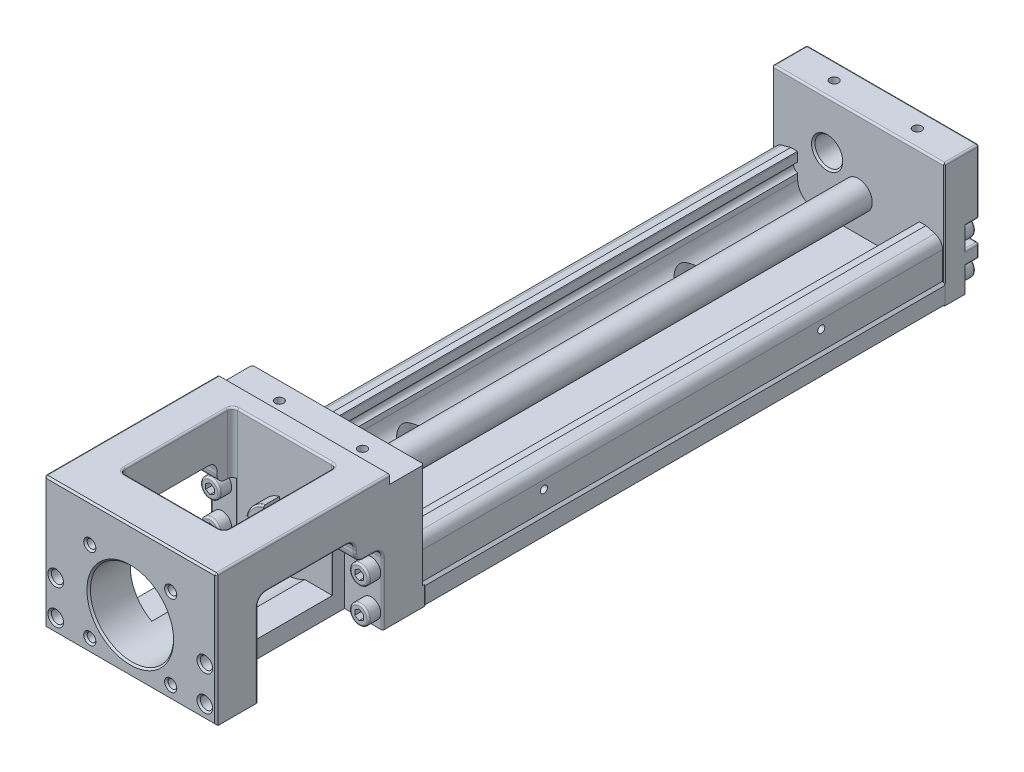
SolidWorks part; units mm, degrees
ref_plane "前视基准面" through (0, 0, 0) normal (0, 0, 1) x (1, 0, 0)
ref_plane "上视基准面" through (0, 0, 0) normal (0, 1, 0) x (1, 0, 0)
ref_plane "右视基准面" through (0, 0, 0) normal (1, 0, 0) x (0, 0, -1)
sketch "Model" plane through (0, 0, 0) normal (0, 0, 1) x (1, 0, 0)
  line L0 (26.1875, 16.7592) -> (26.6875, 16.2592)
  line L1 (23.1875, 16.7592) -> (26.1875, 16.7592)
  line L2 (22.6875, 17.2592) -> (23.1875, 16.7592)
  line L3 (22.6875, 17.2592) -> (22.6875, 22.0592)
  line L4 (23.3875, 22.7592) -> (22.6875, 22.0592)
  line L5 (23.3875, 30.671) -> (23.3875, 22.7592)
  line L6 (28.1875, 34.2592) -> (25.6111, 33.5688)
  line L7 (28.1875, 34.2592) -> (30.0875, 34.2592)
  line L8 (30.1875, 31.6398) -> (30.1875, 33.9592)
  line L9 (30.1875, 27.2592) -> (30.1875, 28.8785)
  line L10 (60.1875, 22.2592) -> (35.1875, 22.2592)
  line L11 (65.1875, 28.8785) -> (65.1875, 27.2592)
  line L12 (65.1875, 33.9592) -> (65.1875, 31.6398)
  line L13 (65.2875, 34.2592) -> (67.1875, 34.2592)
  line L14 (69.764, 33.5688) -> (67.1875, 34.2592)
  line L15 (71.9875, 22.7592) -> (71.9875, 30.671)
  line L16 (72.6875, 22.0592) -> (71.9875, 22.7592)
  line L17 (72.1875, 16.7592) -> (72.6875, 17.2592)
  line L18 (69.1875, 16.7592) -> (72.1875, 16.7592)
  line L19 (68.6875, 16.2592) -> (69.1875, 16.7592)
  line L20 (68.6875, 16.2592) -> (54.6875, 16.2592)
  line L21 (54.1875, 16.7592) -> (54.6875, 16.2592)
  line L22 (41.1875, 16.7592) -> (54.1875, 16.7592)
  line L23 (40.6875, 16.2592) -> (41.1875, 16.7592)
  line L24 (40.6875, 16.2592) -> (26.6875, 16.2592)
  line L25 (72.6875, 22.0592) -> (72.6875, 17.2592)
  arc A0 (25.6111, 33.5688) -> (23.3875, 30.671) centre (26.3875, 30.671) ccw
  arc A1 (30.1875, 33.9592) -> (30.0875, 34.2592) centre (29.6875, 33.9592) ccw
  arc A2 (30.1875, 31.6398) -> (29.0253, 30.2592) centre (30.4965, 30.2002) ccw
  arc A3 (29.0253, 30.2592) -> (30.1875, 28.8785) centre (30.4965, 30.3181) ccw
  arc A4 (30.1875, 27.2592) -> (35.1875, 22.2592) centre (35.1875, 27.2592) ccw
  arc A5 (60.1875, 22.2592) -> (65.1875, 27.2592) centre (60.1875, 27.2592) ccw
  arc A6 (65.1875, 28.8785) -> (66.3498, 30.2592) centre (64.8786, 30.3181) ccw
  arc A7 (66.3498, 30.2592) -> (65.1875, 31.6398) centre (64.8786, 30.2002) ccw
  arc A8 (65.2875, 34.2592) -> (65.1875, 33.9592) centre (65.6875, 33.9592) ccw
  arc A9 (71.9875, 30.671) -> (69.764, 33.5688) centre (68.9875, 30.671) ccw
extrude "凸台-拉伸1" add sketch "Model" along normal mid plane 150
hole_wizard "打孔尺寸(%根据)内六角圆柱头螺钉的类型1" positions "草图2" profile "草图1" counterbore size "M4" standard "GB"
sketch "草图2" plane through (0, 22.2592, 0) normal (0, 1, 0) x (1, 0, 0)
  line L0 (47.6875, -75) -> (47.6875, 75) construction
  line L1 (60.1875, -75) -> (35.1875, -75) construction
  line L2 (60.1875, 75) -> (35.1875, 75) construction
  point P0 (35.1875, -40)
  point P2 (60.1875, -40)
  dimension "D1" = 25
  dimension "D2" = 35
sketch "草图1" plane through (35.1875, 22.2592, 40) normal (1, 0, 0) x (0, 0, 1)
  line L0 (0, 0) -> (0, 6)
  line L1 (0, 6) -> (2.25, 6)
  line L3 (2.25, 6) -> (2.25, 4.6)
  line L4 (2.25, 4.6) -> (4, 4.6)
  line L5 (4, 4.6) -> (4, 0)
  line L7 (4, 0) -> (0, 0)
  line L11 (0, -6.35) -> (0, 107.95) construction
  dimension "通孔孔直径" = 4.5
  dimension "通孔孔深度" = 6
  dimension "柱形沉头孔直径" = 8
  dimension "柱形沉头孔深度" = 4.6
sketch "草图3" plane through (0, 22.2592, 0) normal (0, 1, 0) x (1, 0, 0)
  circle A0 centre (35.1875, -40) radius 4 construction
  circle A1 centre (60.1875, -40) radius 4 construction
  circle A2 centre (35.1875, -40) radius 4
  circle A3 centre (60.1875, -40) radius 4
extrude "切除-拉伸1" cut sketch "草图3" along normal blind 150
pattern_linear "阵列(线性)1" count 2 spacing 80 along (0, 0, -1) of "切除-拉伸1", "打孔尺寸(%根据)内六角圆柱头螺钉的类型1"
hole_wizard "M2.5 螺纹孔1" positions "草图5" profile "草图6" tap size "M2.5" standard "GB"
sketch "草图5" plane through (71.9875, 0, 0) normal (1, 0, 0) x (0, 0, -1)
  line L0 (-75, 22.7592) -> (-75, 30.671) construction
  line L1 (-75, 16.2592) -> (75, 16.2592) construction
  point P0 (-40, 28.2592)
  dimension "D1" = 35
  dimension "D2" = 12
sketch "草图6" plane through (71.9875, 28.2592, 40) normal (0, 1, 0) x (0, 0, -1)
  line L0 (0, 0) -> (0, 5.6159)
  line L1 (0, 5.6159) -> (1.025, 5)
  line L2 (1.025, 5) -> (1.025, 0)
  line L5 (1.025, 0) -> (0, 0)
  line L10 (0, 5.6159) -> (-1.025, 5) construction
  line L11 (0, -6.35) -> (0, 107.95) construction
  dimension "螺纹孔钻头直径" = 2.05
  dimension "螺纹孔钻头深度" = 5
  dimension "导头角度" = 118
hole_wizard "M2.5 螺纹孔2" positions "草图8" profile "草图7" tap size "M2.5" standard "GB"
sketch "草图8" plane through (23.3875, 0, 0) normal (-1, 0, 0) x (0, 0, 1)
  point P0 (40, 28.2592)
sketch "草图7" plane through (23.3875, 28.2592, 40) normal (0, 1, 0) x (0, 0, 1)
  line L0 (0, 0) -> (0, 5.6159)
  line L1 (0, 5.6159) -> (1.025, 5)
  line L2 (1.025, 5) -> (1.025, 0)
  line L5 (1.025, 0) -> (0, 0)
  line L10 (0, 5.6159) -> (-1.025, 5) construction
  line L11 (0, -6.35) -> (0, 107.95) construction
  dimension "螺纹孔钻头直径" = 2.05
  dimension "螺纹孔钻头深度" = 5
  dimension "导头角度" = 118
pattern_linear "阵列(线性)2" count 2 spacing 80 along (0, 0, -1) of "M2.5 螺纹孔2", "M2.5 螺纹孔1"
sketch "草图9" plane through (0, 0, 75) normal (0, 0, 1) x (1, 0, 0)
  line L0 (47.6875, 16.7592) -> (47.6875, 50.1591) construction
  line L1 (22.8875, 54.7592) -> (72.4875, 54.7592)
  line L2 (22.8875, 54.7592) -> (22.8875, 16.7592)
  line L3 (22.8875, 16.7592) -> (72.4875, 16.7592)
  line L4 (72.4875, 54.7592) -> (72.4875, 16.7592)
  line L5 (41.1875, 16.7592) -> (54.1875, 16.7592) construction
  line L6 (26.6875, 16.2592) -> (40.6875, 16.2592) construction
  line L7 (54.6875, 16.2592) -> (68.6875, 16.2592) construction
  circle A0 centre (47.6875, 32.2592) radius 4
  dimension "D4" = 8
  dimension "D5" = 16
  dimension "D1" = 49.6
  dimension "D2" = 0.5
  dimension "D3" = 38.5
extrude "凸台-拉伸2" add sketch "草图9" along normal blind 60
sketch "草图10" plane through (72.4875, 0, 0) normal (1, 0, 0) x (0, 0, -1)
  line L0 (-87, 16.7592) -> (-87, 37.2592)
  line L1 (-135, 16.7592) -> (-75, 16.7592) construction
  line L2 (-87, 37.2592) -> (-95, 37.2592)
  line L3 (-95, 37.2592) -> (-95, 43.2592)
  line L4 (-95, 43.2592) -> (-123, 43.2592)
  line L5 (-123, 43.2592) -> (-123, 16.7592)
  line L6 (-123, 16.7592) -> (-87, 16.7592)
  line L7 (-75, 22.2592) -> (-75, 54.7592) construction
  dimension "D1" = 12
  dimension "D2" = 8
  dimension "D3" = 36
  dimension "D4" = 20.5
  dimension "D5" = 26.5
extrude "切除-拉伸2" cut sketch "草图10" against normal blind 11
sketch "草图11" plane through (22.8875, 0, 0) normal (-1, 0, 0) x (0, 0, 1)
  line L6 (87, 16.7592) -> (123, 16.7592)
  line L7 (87, 37.2592) -> (87, 16.7592)
  line L8 (95, 37.2592) -> (87, 37.2592)
  line L9 (95, 43.2592) -> (95, 37.2592)
  line L10 (123, 43.2592) -> (95, 43.2592)
  line L11 (123, 16.7592) -> (123, 43.2592)
  line L12 (87, 16.7592) -> (123, 16.7592)
  line L13 (87, 37.2592) -> (87, 16.7592)
  line L14 (95, 37.2592) -> (87, 37.2592)
  line L15 (95, 43.2592) -> (95, 37.2592)
  line L16 (123, 43.2592) -> (95, 43.2592)
  line L17 (123, 16.7592) -> (123, 43.2592)
  dimension "D1" = 0
extrude "切除-拉伸3" cut sketch "草图11" against normal blind 11
sketch "草图12" plane through (0, 54.7592, 0) normal (0, 1, 0) x (1, 0, 0)
  line L0 (47.6875, 75) -> (47.6875, -135) construction
  line L1 (60.1875, 75) -> (35.1875, 75) construction
  line L2 (72.4875, -135) -> (22.8875, -135) construction
  line L3 (60.1875, -75) -> (35.1875, -75) construction
  line L4 (32.6875, -90.5) -> (62.6875, -90.5)
  line L5 (32.6875, -90.5) -> (32.6875, -123)
  line L6 (32.6875, -123) -> (62.6875, -123)
  line L7 (62.6875, -90.5) -> (62.6875, -123)
  dimension "D1" = 15.5
  dimension "D2" = 32.5
  dimension "D3" = 30
extrude "切除-拉伸4" cut sketch "草图12" against normal blind 33
sketch "草图13" plane through (0, 0, 135) normal (0, 0, 1) x (1, 0, 0)
  circle A0 centre (47.6875, 32.2592) radius 12
  dimension "D1" = 24
extrude "切除-拉伸5" cut sketch "草图13" against normal up to surface (44.5 mm away)
sketch "草图15" plane through (22.8875, 0, 0) normal (-1, 0, 0) x (0, 0, 1)
  line L1 (75, 54.7592) -> (85, 54.7592)
  line L2 (75, 54.7592) -> (75, 52.2592)
  line L3 (75, 52.2592) -> (85, 52.2592)
  line L4 (85, 54.7592) -> (85, 52.2592)
  dimension "D1" = 2.5
  dimension "D2" = 10
extrude "切除-拉伸6" cut sketch "草图15" against normal through all
hole_wizard "M3 螺纹孔1" positions "草图18" profile "草图17" tap size "M3" standard "GB"
sketch "草图18" plane through (0, 0, 135) normal (0, 0, 1) x (1, 0, 0)
  line L0 (47.6875, 44.2592) -> (47.6875, 32.2592) construction
  line L1 (47.6875, 32.2592) -> (35.6875, 32.2592) construction
  line L3 (36.0203, 43.9264) -> (59.3548, 20.5919) construction
  line L5 (59.3548, 43.9264) -> (36.0203, 20.5919) construction
  circle A0 centre (47.6875, 32.2592) radius 12 construction
  circle A1 centre (47.6875, 32.2592) radius 16.5
  point P0 (36.0203, 43.9264)
  point P16 (59.3548, 20.5919)
  point P18 (59.3548, 43.9264)
  point P19 (36.0203, 20.5919)
  dimension "D1" = 33
  dimension "D2" = 45
sketch "草图17" plane through (36.0203, 43.9264, 135) normal (1, 0, 0) x (0, -1, 0)
  line L0 (0, 0) -> (0, 9.2511)
  line L1 (0, 9.2511) -> (1.25, 8.5)
  line L2 (1.25, 8.5) -> (1.25, 0)
  line L5 (1.25, 0) -> (0, 0)
  line L10 (0, 9.2511) -> (-1.25, 8.5) construction
  line L11 (0, -6.35) -> (0, 107.95) construction
  dimension "螺纹孔钻头直径" = 2.5
  dimension "螺纹孔钻头深度" = 8.5
  dimension "导头角度" = 118
sketch "草图19" plane through (0, 0, 135) normal (0, 0, 1) x (1, 0, 0)
  line L0 (47.6875, 54.7592) -> (47.6875, 16.7592) construction
  line L1 (72.4875, 54.7592) -> (22.8875, 54.7592) construction
  line L2 (22.8875, 16.7592) -> (72.4875, 16.7592) construction
  circle A0 centre (26.1875, 30.7592) radius 1.75
  circle A1 centre (26.1875, 20.7592) radius 1.75
  circle A2 centre (69.1875, 30.7592) radius 1.75
  circle A3 centre (69.1875, 20.7592) radius 1.75
  dimension "D1" = 43
  dimension "D2" = 4
  dimension "D3" = 10
  dimension "D4" = 3.5
extrude "切除-拉伸7" cut sketch "草图19" against normal blind 33
fillet "圆角1" radius 2.5 8 edges at (27.7875, 43.2592, 123) (67.5875, 43.2592, 123) (66.9875, 37.2592, 87) (67.5875, 37.2592, 95) (67.5875, 43.2592, 95) (28.3875, 37.2592, 87) (27.7875, 37.2592, 95) (27.7875, 43.2592, 95)
fillet "圆角2" radius 1.5 4 edges at (32.6875, 47.7592, 123) (32.6875, 46.0092, 90.5) (62.6875, 47.7592, 123) (62.6875, 46.0092, 90.5)
fillet "圆角3" radius 0.5 28 edges at (72.4875, 25.7592, 87) (72.4875, 36.5269, 87.7322) (72.4875, 37.2592, 91) (72.4875, 37.9914, 94.2678) (72.4875, 40.2592, 95) (72.4875, 42.5269, 95.7322) (72.4875, 28.7592, 123) (72.4875, 42.5269, 122.2678) (22.8875, 25.7592, 87) (22.8875, 28.7592, 123) (22.8875, 42.5269, 122.2678) (22.8875, 43.2592, 109) (22.8875, 42.5269, 95.7322) (22.8875, 40.2592, 95) (22.8875, 37.9914, 94.2678) (22.8875, 37.2592, 91) (62.2482, 54.7592, 90.9393) (62.6875, 54.7592, 106.75) (62.2482, 54.7592, 122.5607) (47.6875, 54.7592, 123) (33.1269, 54.7592, 122.5607) (32.6875, 54.7592, 106.75) (33.1269, 54.7592, 90.9393) (72.4875, 43.2592, 109) (22.8875, 36.5269, 87.7322) (47.6875, 54.7592, 90.5) (72.4875, 54.7592, 110) (22.8875, 54.7592, 110)
chamfer "倒角1" distance 0.5 angle 45 17 edges at (47.6875, 16.7592, 135) (22.8875, 35.5092, 135) (23.034, 54.6127, 135) (47.6875, 54.7592, 135) (72.3411, 54.6127, 135) (72.4875, 35.5092, 135) (59.6875, 32.2592, 135) (37.2703, 20.5919, 135) (60.6048, 43.9264, 135) (60.6048, 20.5919, 135) (37.2703, 43.9264, 135) (27.9375, 30.7592, 135) (27.9375, 20.7592, 135) (70.9375, 30.7592, 135) (70.9375, 20.7592, 135) (22.8875, 37.2592, 75) (72.4875, 37.2592, 75)
sketch "草图20" plane through (0, 0, 90.5) normal (0, 0, 1) x (1, 0, 0)
  circle A0 centre (47.6875, 32.2592) radius 4 construction
  circle A1 centre (47.6875, 32.2592) radius 4
extrude "凸台-拉伸3" add sketch "草图20" against normal up to surface (165.5 mm away)
sketch "草图21" plane through (0, 0, 90.5) normal (0, 0, 1) x (1, 0, 0)
  line L0 (47.6875, 39.0092) -> (47.6875, 25.5092) construction
  line L1 (42.9375, 32.2592) -> (52.4375, 32.2592) construction
  line L2 (46.1875, 38.8404) -> (46.1875, 36.7661)
  line L3 (41.1063, 30.7592) -> (43.1806, 30.7592)
  line L4 (49.1875, 38.8404) -> (49.1875, 36.7661)
  line L5 (41.1063, 33.7592) -> (43.1806, 33.7592)
  line L6 (46.1875, 33.7592) -> (46.1875, 30.7592) construction
  line L7 (46.1875, 39.0092) -> (46.1875, 25.5092) construction
  line L8 (49.1875, 39.0092) -> (49.1875, 25.5092) construction
  line L9 (49.1875, 33.7592) -> (49.1875, 30.7592) construction
  line L10 (42.9375, 33.7592) -> (52.4375, 33.7592) construction
  line L11 (42.9375, 30.7592) -> (52.4375, 30.7592) construction
  line L12 (52.1945, 30.7592) -> (54.2688, 30.7592)
  line L13 (52.1945, 33.7592) -> (54.2688, 33.7592)
  line L14 (46.1875, 33.7592) -> (49.1875, 33.7592) construction
  line L15 (46.1875, 30.7592) -> (49.1875, 30.7592) construction
  line L16 (46.1875, 27.7522) -> (46.1875, 25.6779)
  line L17 (49.1875, 27.7522) -> (49.1875, 25.6779)
  arc A0 (46.1875, 38.8404) -> (41.1063, 33.7592) centre (47.6875, 32.2592) ccw
  arc A1 (49.1875, 36.7661) -> (46.1875, 36.7661) centre (47.6875, 32.2592) ccw
  arc A2 (43.1806, 33.7592) -> (43.1806, 30.7592) centre (47.6875, 32.2592) ccw
  arc A3 (41.1063, 30.7592) -> (46.1875, 25.6779) centre (47.6875, 32.2592) ccw
  arc A4 (49.1875, 25.6779) -> (54.2688, 30.7592) centre (47.6875, 32.2592) ccw
  arc A5 (54.2688, 33.7592) -> (49.1875, 38.8404) centre (47.6875, 32.2592) ccw
  arc A6 (46.1875, 27.7522) -> (49.1875, 27.7522) centre (47.6875, 32.2592) ccw
  arc A7 (52.1945, 30.7592) -> (52.1945, 33.7592) centre (47.6875, 32.2592) ccw
  dimension "D1" = 13.5
  dimension "D3" = 9.5
  dimension "D4" = 1.5
  dimension "D5" = 1.5
extrude "凸台-拉伸4" add sketch "草图21" along normal blind 4.5
sketch "草图22" plane through (0, 0, 95) normal (0, 0, 1) x (1, 0, 0)
  circle A0 centre (47.6875, 32.2592) radius 3
  dimension "D1" = 6
extrude "凸台-拉伸5" add sketch "草图22" along normal blind 0.5
sketch "草图23" plane through (0, 0, 95.5) normal (0, 0, 1) x (1, 0, 0)
  circle A0 centre (47.6875, 32.2592) radius 2.5
  dimension "D1" = 5
extrude "凸台-拉伸6" add sketch "草图23" along normal blind 10
fillet "圆角4" radius 0.5 4 edges at (52.4605, 27.4862, 95) (42.9146, 27.4862, 95) (42.9146, 37.0321, 95) (52.4605, 37.0321, 95)
sketch "草图24" plane through (0, 0, 87) normal (0, 0, 1) x (1, 0, 0)
  circle A0 centre (26.1875, 30.7592) radius 2.75
  circle A1 centre (26.1875, 20.7592) radius 2.75
  circle A2 centre (69.1875, 30.7592) radius 2.75
  circle A3 centre (69.1875, 20.7592) radius 2.75
  dimension "D1" = 5.5
extrude "凸台-拉伸7" add sketch "草图24" along normal blind 3.5
sketch "草图25" plane through (0, 0, 90.5) normal (0, 0, 1) x (1, 0, 0)
  line L1 (26.1875, 32.2025) -> (24.9375, 31.4808)
  line L2 (24.9375, 31.4808) -> (24.9375, 30.0375)
  line L3 (24.9375, 30.0375) -> (26.1875, 29.3158)
  line L4 (26.1875, 29.3158) -> (27.4375, 30.0375)
  line L5 (27.4375, 30.0375) -> (27.4375, 31.4808)
  line L6 (27.4375, 31.4808) -> (26.1875, 32.2025)
  line L7 (26.1875, 22.2025) -> (24.9375, 21.4808)
  line L8 (24.9375, 21.4808) -> (24.9375, 20.0375)
  line L9 (24.9375, 20.0375) -> (26.1875, 19.3158)
  line L10 (26.1875, 19.3158) -> (27.4375, 20.0375)
  line L11 (27.4375, 20.0375) -> (27.4375, 21.4808)
  line L12 (27.4375, 21.4808) -> (26.1875, 22.2025)
  line L13 (69.1875, 22.2025) -> (67.9375, 21.4808)
  line L14 (67.9375, 21.4808) -> (67.9375, 20.0375)
  line L15 (67.9375, 20.0375) -> (69.1875, 19.3158)
  line L16 (69.1875, 19.3158) -> (70.4375, 20.0375)
  line L17 (70.4375, 20.0375) -> (70.4375, 21.4808)
  line L18 (70.4375, 21.4808) -> (69.1875, 22.2025)
  line L19 (69.1875, 32.2025) -> (67.9375, 31.4808)
  line L20 (67.9375, 31.4808) -> (67.9375, 30.0375)
  line L21 (67.9375, 30.0375) -> (69.1875, 29.3158)
  line L22 (69.1875, 29.3158) -> (70.4375, 30.0375)
  line L23 (70.4375, 30.0375) -> (70.4375, 31.4808)
  line L24 (70.4375, 31.4808) -> (69.1875, 32.2025)
  circle A0 centre (26.1875, 30.7592) radius 1.25 construction
  circle A1 centre (26.1875, 20.7592) radius 1.25 construction
  circle A2 centre (69.1875, 20.7592) radius 1.25 construction
  circle A3 centre (69.1875, 30.7592) radius 1.25 construction
  dimension "D1" = 2.5
extrude "切除-拉伸8" cut sketch "草图25" against normal blind 2.5
fillet "圆角5" radius 0.5 4 edges at (71.9375, 30.7592, 90.5) (71.9375, 20.7592, 90.5) (28.9375, 20.7592, 90.5) (28.9375, 30.7592, 90.5)
sketch "草图26" plane through (0, 0, 75) normal (0, 0, -1) x (-1, 0, 0)
  line L0 (-61.1875, 32.2592) -> (-34.1875, 32.2592) construction
  line L13 (-57.7499, 23.2592) -> (-37.6252, 23.2592)
  line L14 (-57.7499, 41.2592) -> (-37.6252, 41.2592)
  line L16 (-61.1875, 41.2592) -> (-34.1875, 41.2592) construction
  line L17 (-61.1875, 23.2592) -> (-34.1875, 23.2592) construction
  arc A0 (-57.7499, 41.2592) -> (-57.7499, 23.2592) centre (-47.6875, 32.2592) ccw
  arc A11 (-37.6252, 23.2592) -> (-37.6252, 41.2592) centre (-47.6875, 32.2592) ccw
  circle A12 centre (-47.6875, 32.2592) radius 6
  dimension "D1" = 27
  dimension "D4" = 12
  dimension "D2" = 9
  dimension "D3" = 9
extrude "凸台-拉伸8" add sketch "草图26" along normal blind 2.5
chamfer "倒角2" distance 0.5 angle 45 5 edges at (41.6875, 32.2592, 72.5) (47.6875, 23.2592, 72.5) (61.1875, 32.2592, 72.5) (47.6875, 41.2592, 72.5) (34.1875, 32.2592, 72.5)
sketch "草图27" plane through (0, 0, 72.5) normal (0, 0, -1) x (-1, 0, 0)
  line L0 (-47.6875, 43.2592) -> (-47.6875, 32.2592) construction
  line L1 (-47.6875, 32.2592) -> (-58.6875, 32.2592) construction
  line L2 (-57.2138, 37.7592) -> (-38.1613, 26.7592) construction
  line L3 (-38.1613, 37.7592) -> (-57.2138, 26.7592) construction
  circle A0 centre (-47.6875, 32.2592) radius 11 construction
  circle A1 centre (-57.2138, 37.7592) radius 2.75
  circle A2 centre (-57.2138, 26.7592) radius 2.75
  circle A3 centre (-38.1613, 37.7592) radius 2.75
  circle A4 centre (-38.1613, 26.7592) radius 2.75
  dimension "D1" = 22
  dimension "D4" = 5.5
  dimension "D2" = 30
  dimension "D3" = 30
extrude "凸台-拉伸9" add sketch "草图27" along normal blind 3.5
sketch "草图28" plane through (0, 0, 69) normal (0, 0, -1) x (-1, 0, 0)
  line L1 (-57.9355, 39.0092) -> (-58.6572, 37.7592)
  line L2 (-58.6572, 37.7592) -> (-57.9355, 36.5092)
  line L3 (-57.9355, 36.5092) -> (-56.4921, 36.5092)
  line L4 (-56.4921, 36.5092) -> (-55.7704, 37.7592)
  line L5 (-55.7704, 37.7592) -> (-56.4921, 39.0092)
  line L6 (-56.4921, 39.0092) -> (-57.9355, 39.0092)
  line L7 (-38.883, 39.0092) -> (-39.6046, 37.7592)
  line L8 (-39.6046, 37.7592) -> (-38.883, 36.5092)
  line L9 (-38.883, 36.5092) -> (-37.4396, 36.5092)
  line L10 (-37.4396, 36.5092) -> (-36.7179, 37.7592)
  line L11 (-36.7179, 37.7592) -> (-37.4396, 39.0092)
  line L12 (-37.4396, 39.0092) -> (-38.883, 39.0092)
  line L13 (-38.883, 28.0092) -> (-39.6046, 26.7592)
  line L14 (-39.6046, 26.7592) -> (-38.883, 25.5092)
  line L15 (-38.883, 25.5092) -> (-37.4396, 25.5092)
  line L16 (-37.4396, 25.5092) -> (-36.7179, 26.7592)
  line L17 (-36.7179, 26.7592) -> (-37.4396, 28.0092)
  line L18 (-37.4396, 28.0092) -> (-38.883, 28.0092)
  line L19 (-57.9355, 28.0092) -> (-58.6572, 26.7592)
  line L20 (-58.6572, 26.7592) -> (-57.9355, 25.5092)
  line L21 (-57.9355, 25.5092) -> (-56.4921, 25.5092)
  line L22 (-56.4921, 25.5092) -> (-55.7704, 26.7592)
  line L23 (-55.7704, 26.7592) -> (-56.4921, 28.0092)
  line L24 (-56.4921, 28.0092) -> (-57.9355, 28.0092)
  circle A0 centre (-57.2138, 37.7592) radius 1.25 construction
  circle A1 centre (-38.1613, 37.7592) radius 1.25 construction
  circle A2 centre (-38.1613, 26.7592) radius 1.25 construction
  circle A3 centre (-57.2138, 26.7592) radius 1.25 construction
  dimension "D1" = 2.5
extrude "切除-拉伸9" cut sketch "草图28" against normal blind 2.5
fillet "圆角6" radius 0.5 4 edges at (35.4113, 26.7592, 69) (54.4638, 26.7592, 69) (54.4638, 37.7592, 69) (35.4113, 37.7592, 69)
sketch "草图29" plane through (0, 0, -75) normal (0, 0, -1) x (-1, 0, 0)
  line L0 (-69.1875, 16.7592) -> (-72.1875, 16.7592) construction
  line L1 (-72.4875, 52.2592) -> (-22.8875, 52.2592)
  line L2 (-72.4875, 52.2592) -> (-72.4875, 16.7592)
  line L3 (-72.4875, 16.7592) -> (-22.8875, 16.7592)
  line L4 (-22.8875, 52.2592) -> (-22.8875, 16.7592)
  line L5 (-22.8875, 52.2592) -> (-22.8875, 22.2592) construction
  line L6 (-72.4875, 22.2592) -> (-72.4875, 52.2592) construction
  line L8 (-72.4875, 52.2592) -> (-22.8875, 52.2592) construction
extrude "凸台-拉伸10" add sketch "草图29" along normal blind 10
sketch "草图30" plane through (0, 0, -85) normal (0, 0, -1) x (-1, 0, 0)
  circle A0 centre (-47.6875, 32.2592) radius 5.5
  dimension "D1" = 11
extrude "切除-拉伸10" cut sketch "草图30" against normal blind 2.5
sketch "草图31" plane through (0, 0, -82.5) normal (0, 0, -1) x (-1, 0, 0)
  circle A0 centre (-47.6875, 32.2592) radius 2.5
  dimension "D1" = 5
extrude "凸台-拉伸11" add sketch "草图31" along normal blind 2 separate body
sketch "草图32" plane through (0, 0, -82.5) normal (0, 0, -1) x (-1, 0, 0)
  circle A0 centre (-47.6875, 32.2592) radius 3
  circle A1 centre (-47.6875, 32.2592) radius 4.5
  dimension "D1" = 9
  dimension "D2" = 6
extrude "切除-拉伸11" cut sketch "草图32" against normal blind 0.3
chamfer "倒角3" distance 0.3 angle 45 1 edges at (45.1875, 32.2592, -84.5)
chamfer "倒角4" distance 0.3 angle 45 3 edges at (42.1875, 32.2592, -85) (22.8875, 37.2592, -75) (72.4875, 37.2592, -75)
fillet "圆角7" radius 0.3 2 edges at (43.1875, 32.2592, -82.5) (44.6875, 32.2592, -82.5)
fillet "圆角8" radius 0.5 7 edges at (47.6875, 16.7592, -85) (22.8875, 34.5092, -85) (72.4875, 34.5092, -85) (47.6875, 52.2592, -85) (47.6875, 52.2592, -75) (22.8875, 52.2592, -80.15) (72.4875, 52.2592, -80.15)
sketch "草图34" plane through (0, 0, -85) normal (0, 0, -1) x (-1, 0, 0)
  line L0 (-69.1875, 33.7592) -> (-72.4875, 33.7592)
  line L1 (-72.4875, 16.7592) -> (-72.4875, 51.7592) construction
  line L2 (-72.4875, 33.7592) -> (-72.4875, 27.7592)
  line L3 (-72.4875, 27.7592) -> (-69.1875, 27.7592)
  line L4 (-69.1875, 23.7592) -> (-72.4875, 23.7592)
  line L5 (-72.4875, 23.7592) -> (-72.4875, 16.7592)
  line L6 (-72.4875, 16.7592) -> (-66.1875, 16.7592)
  line L7 (-69.1875, 16.7592) -> (-54.1875, 16.7592) construction
  line L8 (-66.1875, 16.7592) -> (-66.1875, 20.7592)
  line L9 (-26.1875, 33.7592) -> (-22.8875, 33.7592)
  line L10 (-22.8875, 51.7592) -> (-22.8875, 16.7592) construction
  line L11 (-22.8875, 33.7592) -> (-22.8875, 27.7592)
  line L12 (-22.8875, 27.7592) -> (-26.1875, 27.7592)
  line L13 (-26.1875, 23.7592) -> (-22.8875, 23.7592)
  line L14 (-22.8875, 23.7592) -> (-22.8875, 16.7592)
  line L15 (-22.8875, 16.7592) -> (-29.1875, 16.7592)
  line L16 (-22.8875, 16.7592) -> (-72.4875, 16.7592) construction
  line L17 (-29.1875, 16.7592) -> (-29.1875, 20.7592)
  arc A0 (-69.1875, 27.7592) -> (-69.1875, 33.7592) centre (-69.1875, 30.7592) ccw
  arc A1 (-66.1875, 20.7592) -> (-69.1875, 23.7592) centre (-69.1875, 20.7592) ccw
  arc A2 (-26.1875, 33.7592) -> (-26.1875, 27.7592) centre (-26.1875, 30.7592) ccw
  arc A3 (-26.1875, 23.7592) -> (-29.1875, 20.7592) centre (-26.1875, 20.7592) ccw
  dimension "D1" = 6
extrude "切除-拉伸12" cut sketch "草图34" against normal blind 4
sketch "草图35" plane through (0, 0, -81) normal (0, 0, -1) x (-1, 0, 0)
  circle A0 centre (-69.1875, 30.7592) radius 2.75 construction
  circle A1 centre (-69.1875, 20.7592) radius 2.75 construction
  circle A2 centre (-26.1875, 30.7592) radius 2.75 construction
  circle A3 centre (-26.1875, 20.7592) radius 2.75 construction
  circle A4 centre (-69.1875, 30.7592) radius 2.75
  circle A5 centre (-69.1875, 20.7592) radius 2.75
  circle A6 centre (-26.1875, 30.7592) radius 2.75
  circle A7 centre (-26.1875, 20.7592) radius 2.75
extrude "凸台-拉伸12" add sketch "草图35" along normal blind 3.5
sketch "草图36" plane through (0, 0, -84.5) normal (0, 0, -1) x (-1, 0, 0)
  line L0 (-70.4375, 31.4808) -> (-69.1875, 32.2025) construction
  line L1 (-69.1875, 32.2025) -> (-67.9375, 31.4808) construction
  line L2 (-67.9375, 31.4808) -> (-67.9375, 30.0375) construction
  line L3 (-67.9375, 30.0375) -> (-69.1875, 29.3158) construction
  line L4 (-69.1875, 29.3158) -> (-70.4375, 30.0375) construction
  line L5 (-70.4375, 30.0375) -> (-70.4375, 31.4808) construction
  line L6 (-70.4375, 21.4808) -> (-69.1875, 22.2025) construction
  line L7 (-69.1875, 22.2025) -> (-67.9375, 21.4808) construction
  line L8 (-67.9375, 21.4808) -> (-67.9375, 20.0375) construction
  line L9 (-67.9375, 20.0375) -> (-69.1875, 19.3158) construction
  line L10 (-69.1875, 19.3158) -> (-70.4375, 20.0375) construction
  line L11 (-70.4375, 20.0375) -> (-70.4375, 21.4808) construction
  line L12 (-27.4375, 21.4808) -> (-26.1875, 22.2025) construction
  line L13 (-26.1875, 22.2025) -> (-24.9375, 21.4808) construction
  line L14 (-24.9375, 21.4808) -> (-24.9375, 20.0375) construction
  line L15 (-24.9375, 20.0375) -> (-26.1875, 19.3158) construction
  line L16 (-26.1875, 19.3158) -> (-27.4375, 20.0375) construction
  line L17 (-27.4375, 20.0375) -> (-27.4375, 21.4808) construction
  line L18 (-27.4375, 31.4808) -> (-26.1875, 32.2025) construction
  line L19 (-26.1875, 32.2025) -> (-24.9375, 31.4808) construction
  line L20 (-24.9375, 31.4808) -> (-24.9375, 30.0375) construction
  line L21 (-24.9375, 30.0375) -> (-26.1875, 29.3158) construction
  line L22 (-26.1875, 29.3158) -> (-27.4375, 30.0375) construction
  line L23 (-27.4375, 30.0375) -> (-27.4375, 31.4808) construction
  line L24 (-70.4375, 31.4808) -> (-69.1875, 32.2025)
  line L25 (-69.1875, 32.2025) -> (-67.9375, 31.4808)
  line L26 (-67.9375, 31.4808) -> (-67.9375, 30.0375)
  line L27 (-67.9375, 30.0375) -> (-69.1875, 29.3158)
  line L28 (-69.1875, 29.3158) -> (-70.4375, 30.0375)
  line L29 (-70.4375, 30.0375) -> (-70.4375, 31.4808)
  line L30 (-70.4375, 21.4808) -> (-69.1875, 22.2025)
  line L31 (-69.1875, 22.2025) -> (-67.9375, 21.4808)
  line L32 (-67.9375, 21.4808) -> (-67.9375, 20.0375)
  line L33 (-67.9375, 20.0375) -> (-69.1875, 19.3158)
  line L34 (-69.1875, 19.3158) -> (-70.4375, 20.0375)
  line L35 (-70.4375, 20.0375) -> (-70.4375, 21.4808)
  line L36 (-27.4375, 21.4808) -> (-26.1875, 22.2025)
  line L37 (-26.1875, 22.2025) -> (-24.9375, 21.4808)
  line L38 (-24.9375, 21.4808) -> (-24.9375, 20.0375)
  line L39 (-24.9375, 20.0375) -> (-26.1875, 19.3158)
  line L40 (-26.1875, 19.3158) -> (-27.4375, 20.0375)
  line L41 (-27.4375, 20.0375) -> (-27.4375, 21.4808)
  line L42 (-27.4375, 31.4808) -> (-26.1875, 32.2025)
  line L43 (-26.1875, 32.2025) -> (-24.9375, 31.4808)
  line L44 (-24.9375, 31.4808) -> (-24.9375, 30.0375)
  line L45 (-24.9375, 30.0375) -> (-26.1875, 29.3158)
  line L46 (-26.1875, 29.3158) -> (-27.4375, 30.0375)
  line L47 (-27.4375, 30.0375) -> (-27.4375, 31.4808)
extrude "切除-拉伸13" cut sketch "草图36" against normal blind 2.5
fillet "圆角9" radius 0.5 32 edges at (66.1875, 16.7592, -82.75) (66.1875, 16.9056, -84.8536) (66.1875, 19.0092, -85) (72.4875, 23.7592, -82.75) (72.3411, 23.7592, -84.8536) (70.5875, 23.7592, -85) (22.8875, 23.7592, -82.75) (23.034, 23.7592, -84.8536) (24.7875, 23.7592, -85) (29.1875, 16.7592, -82.75) (29.1875, 16.9056, -84.8536) (29.1875, 19.0092, -85) (22.8875, 33.7592, -82.75) (23.034, 33.7592, -84.8536) (22.8875, 27.7592, -82.75) (23.034, 27.7592, -84.8536) (24.7875, 27.7592, -85) (29.1875, 30.7592, -85) (72.4875, 27.7592, -82.75) (72.3411, 27.7592, -84.8536) (70.5875, 27.7592, -85) (66.1875, 30.7592, -85) (72.4875, 33.7592, -82.75) (72.3411, 33.7592, -84.8536) (67.0662, 22.8805, -85) (23.4375, 20.7592, -84.5) (28.3089, 22.8805, -85) (24.7875, 33.7592, -85) (23.4375, 30.7592, -84.5) (70.5875, 33.7592, -85) (66.4375, 30.7592, -84.5) (66.4375, 20.7592, -84.5)
hole_wizard "M3 螺纹孔2" positions "草图40" profile "草图39" tap size "M3" standard "GB"
sketch "草图40" plane through (0, 52.2592, 0) normal (0, 1, 0) x (1, 0, 0)
  line L0 (47.6875, 85) -> (47.6875, -134.5) construction
  line L1 (23.3875, 85) -> (71.9875, 85) construction
  line L2 (23.3875, -134.5) -> (71.9875, -134.5) construction
  line L4 (71.9875, -75) -> (23.3875, -75) construction
  point P0 (59.6875, 80)
  point P2 (35.6875, 80)
  point P4 (59.6875, -80)
  point P6 (35.6875, -80)
  dimension "D1" = 5
  dimension "D2" = 24
  dimension "D3" = 5
sketch "草图39" plane through (59.6875, 52.2592, -80) normal (1, 0, 0) x (0, 0, 1)
  line L0 (0, 0) -> (0, 9.2511)
  line L1 (0, 9.2511) -> (1.25, 8.5)
  line L2 (1.25, 8.5) -> (1.25, 0)
  line L5 (1.25, 0) -> (0, 0)
  line L10 (0, 9.2511) -> (-1.25, 8.5) construction
  line L11 (0, -6.35) -> (0, 107.95) construction
  dimension "螺纹孔钻头直径" = 2.5
  dimension "螺纹孔钻头深度" = 8.5
  dimension "导头角度" = 118
sketch "草图41" plane through (0, 16.7592, 0) normal (0, -1, 0) x (1, 0, 0)
  line L0 (23.3875, 135) -> (71.9875, 135) construction
  line L1 (38.6875, 115) -> (56.6875, 115)
  line L2 (36.6875, 113) -> (36.6875, 101)
  line L3 (38.6875, 99) -> (56.6875, 99)
  line L4 (58.6875, 113) -> (58.6875, 101)
  line L5 (47.6875, 135) -> (47.6875, 91.4107) construction
  arc A0 (36.6875, 101) -> (38.6875, 99) centre (38.6875, 101) ccw
  arc A1 (56.6875, 99) -> (58.6875, 101) centre (56.6875, 101) ccw
  arc A2 (58.6875, 113) -> (56.6875, 115) centre (56.6875, 113) ccw
  arc A3 (36.6875, 113) -> (38.6875, 115) centre (38.6875, 113) cw
  point P12 (58.6875, 99)
  point P15 (58.6875, 115)
  point P18 (36.6875, 115)
  dimension "D4" = 2
  dimension "D1" = 20
  dimension "D2" = 16
  dimension "D3" = 22
extrude "切除-拉伸14" cut sketch "草图41" against normal blind 0.2
sketch "草图42" plane through (0, 16.9592, 0) normal (0, -1, 0) x (1, 0, 0)
  line L0 (36.6875, 113) -> (36.6875, 101) construction
  line L1 (38.6875, 99) -> (56.6875, 99) construction
  text T0 "KKR50" font "仿宋" height 5
  dimension "D1" = 2
  dimension "D2" = 5.5
extrude "凸台-拉伸13" add sketch "草图42" along normal blind 0.2
sketch "草图43" plane through (0, 0, -75) normal (0, 0, 1) x (1, 0, 0)
  circle A0 centre (38.6875, 38.2592) radius 4
  circle A1 centre (47.6875, 32.2592) radius 4 construction
  dimension "D1" = 9
  dimension "D2" = 6
  dimension "D3" = 8
extrude "切除-拉伸15" cut sketch "草图43" against normal blind 8
chamfer "倒角5" distance 0.5 angle 45 1 edges at (42.6875, 38.2592, -75)
